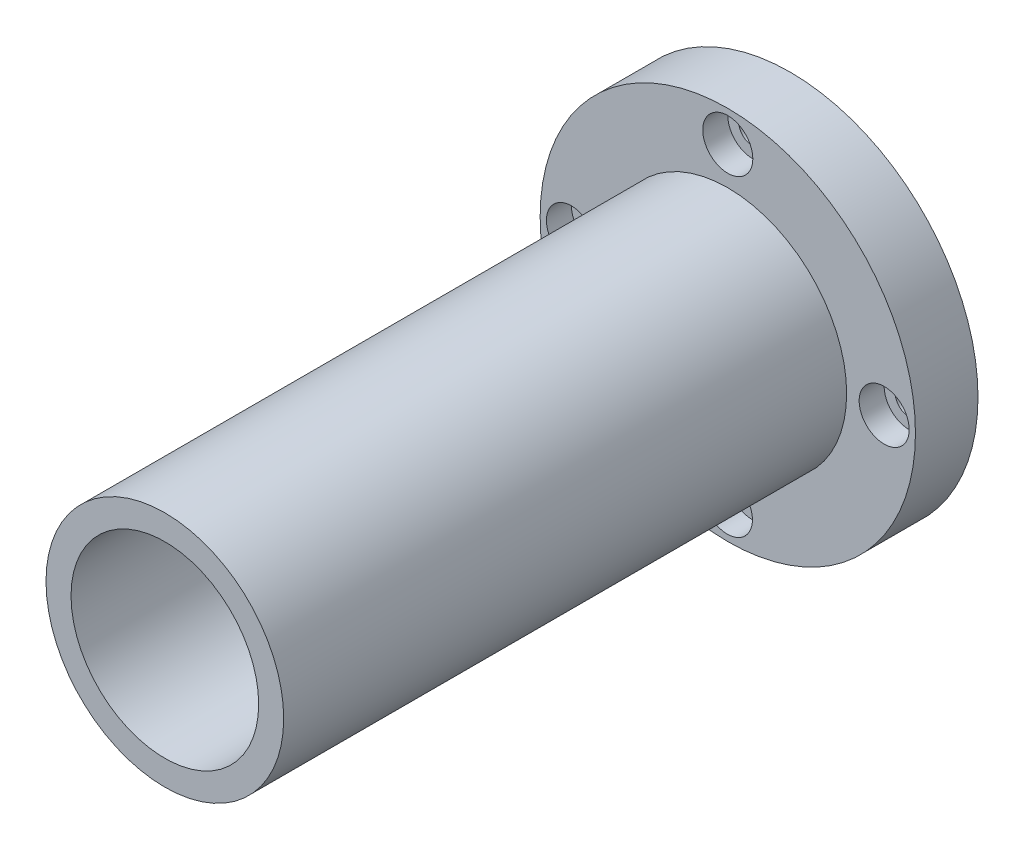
SolidWorks part; units mm, degrees
ref_plane "前基準面" through (0, 0, 0) normal (0, 0, 1) x (1, 0, 0)
ref_plane "上基準面" through (0, 0, 0) normal (0, 1, 0) x (1, 0, 0)
ref_plane "右基準面" through (0, 0, 0) normal (1, 0, 0) x (0, 0, -1)
sketch "草圖1" plane through (0, 0, 0) normal (0, 0, 1) x (1, 0, 0)
  circle A0 centre (0, 0) radius 30
  circle A1 centre (0, 0) radius 15
  dimension "D1" = 60
  dimension "D2" = 30
extrude "填料-伸長1" add sketch "草圖1" along normal blind 10
sketch "草圖2" plane through (0, 0, 10) normal (0, 0, 1) x (1, 0, 0)
  circle A0 centre (0, 0) radius 15
  circle A1 centre (0, 0) radius 19
  dimension "D1" = 38
  dimension "D2" = 30
extrude "填料-伸長2" add sketch "草圖2" along normal blind 90
hole_wizard "M4 六角承窩頭蓋螺釘的柱孔1" positions "草圖6" profile "草圖5" counterbore size "M4" standard "ISO"
sketch "草圖6" plane through (0, 0, 10) normal (0, 0, 1) x (1, 0, 0)
  circle A5 centre (0, 0) radius 15 construction
  point P0 (0, 25)
  point P1 (25, 0)
  point P3 (-0.0636, -24.9999)
  point P5 (-25, 0)
  dimension "D1" = 25
  dimension "D2" = 25
  dimension "D3" = 24.9999
  dimension "D4" = 25
sketch "草圖5" plane through (0, 25, 10) normal (1, 0, 0) x (0, -1, 0)
  line L0 (0, 0) -> (0, 10)
  line L1 (0, 10) -> (2.25, 10)
  line L3 (2.25, 10) -> (2.25, 4)
  line L4 (2.25, 4) -> (4, 4)
  line L5 (4, 4) -> (4, 0)
  line L7 (4, 0) -> (0, 0)
  line L11 (0, -6.35) -> (0, 107.95) construction
  dimension "貫穿孔直徑" = 4.5
  dimension "貫穿孔深度" = 10
  dimension "柱孔直徑" = 8
  dimension "柱孔深度" = 4
